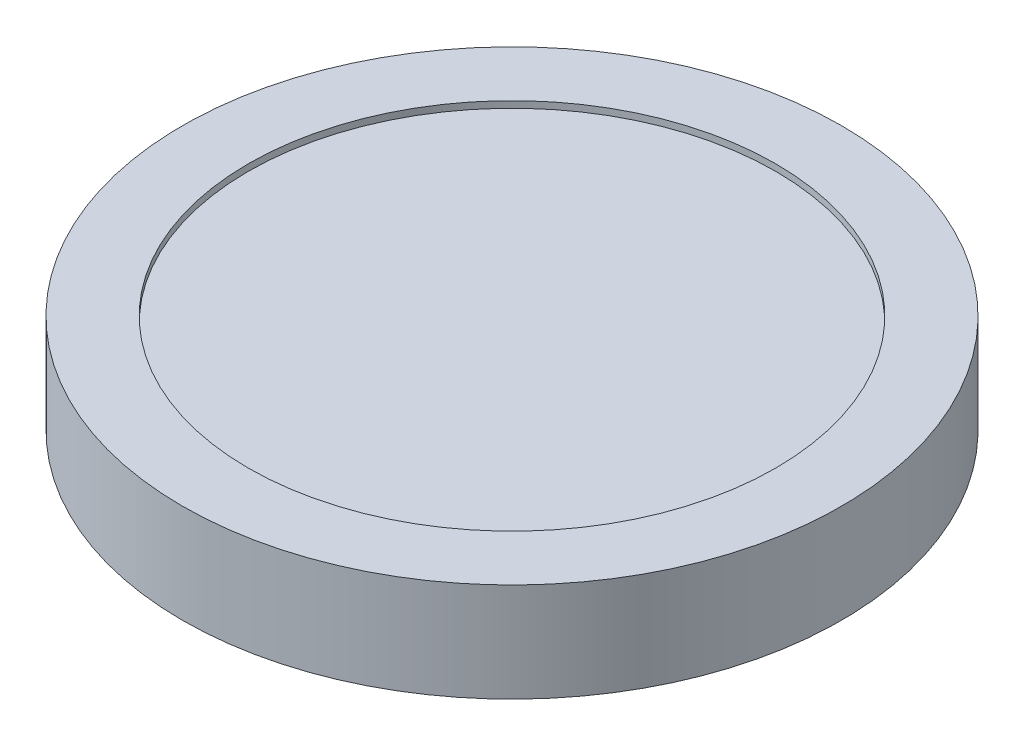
SolidWorks part; units mm, degrees
ref_plane "Plan de face" through (0, 0, 0) normal (0, 0, 1) x (1, 0, 0)
ref_plane "Plan de dessus" through (0, 0, 0) normal (0, 1, 0) x (1, 0, 0)
ref_plane "Plan de droite" through (0, 0, 0) normal (1, 0, 0) x (0, 0, -1)
sketch "Esquisse1" plane through (0, 0, 0) normal (0, 1, 0) x (1, 0, 0)
  circle A0 centre (0, 0) radius 50
extrude "Boss.-Extru.1" add sketch "Esquisse1" along normal blind 15
sketch "Esquisse2" plane through (0, 15, 0) normal (0, 1, 0) x (1, 0, 0)
  circle A0 centre (0, 0) radius 40
extrude "Enlèv. mat.-Extru.1" cut sketch "Esquisse2" against normal blind 1
sketch "Esquisse3" plane through (0, 0, 0) normal (0, -1, 0) x (1, 0, 0)
  circle A0 centre (0, 0) radius 48.5
extrude "Enlèv. mat.-Extru.2" cut sketch "Esquisse3" against normal blind 13.5
